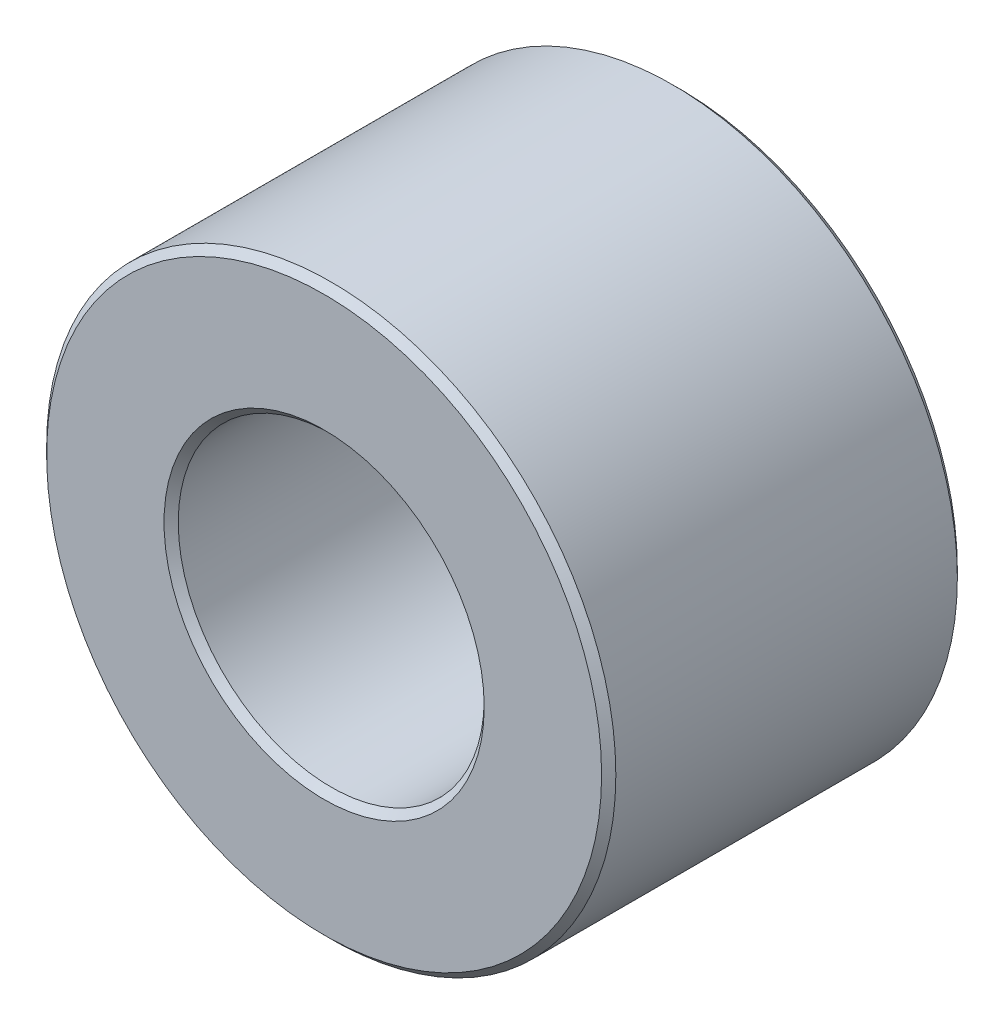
SolidWorks part; units mm, degrees
ref_plane "Front Plane" through (0, 0, 0) normal (0, 0, 1) x (1, 0, 0)
ref_plane "Top Plane" through (0, 0, 0) normal (0, 1, 0) x (1, 0, 0)
ref_plane "Right Plane" through (0, 0, 0) normal (1, 0, 0) x (0, 0, -1)
sketch "Sketch1" plane through (0, 0, 0) normal (0, 0, 1) x (1, 0, 0)
  circle A0 centre (0, 0) radius 4
  circle A1 centre (0, 0) radius 2.15
  dimension "D1" = 8
  dimension "D2" = 4.3
extrude "Boss-Extrude2" add sketch "Sketch1" along normal mid plane 5
chamfer "Chamfer3" distance 0.1 angle 45 4 edges at (4, 0, 2.5) (4, 0, -2.5) (2.15, 0, -2.5) (2.15, 0, 2.5)
